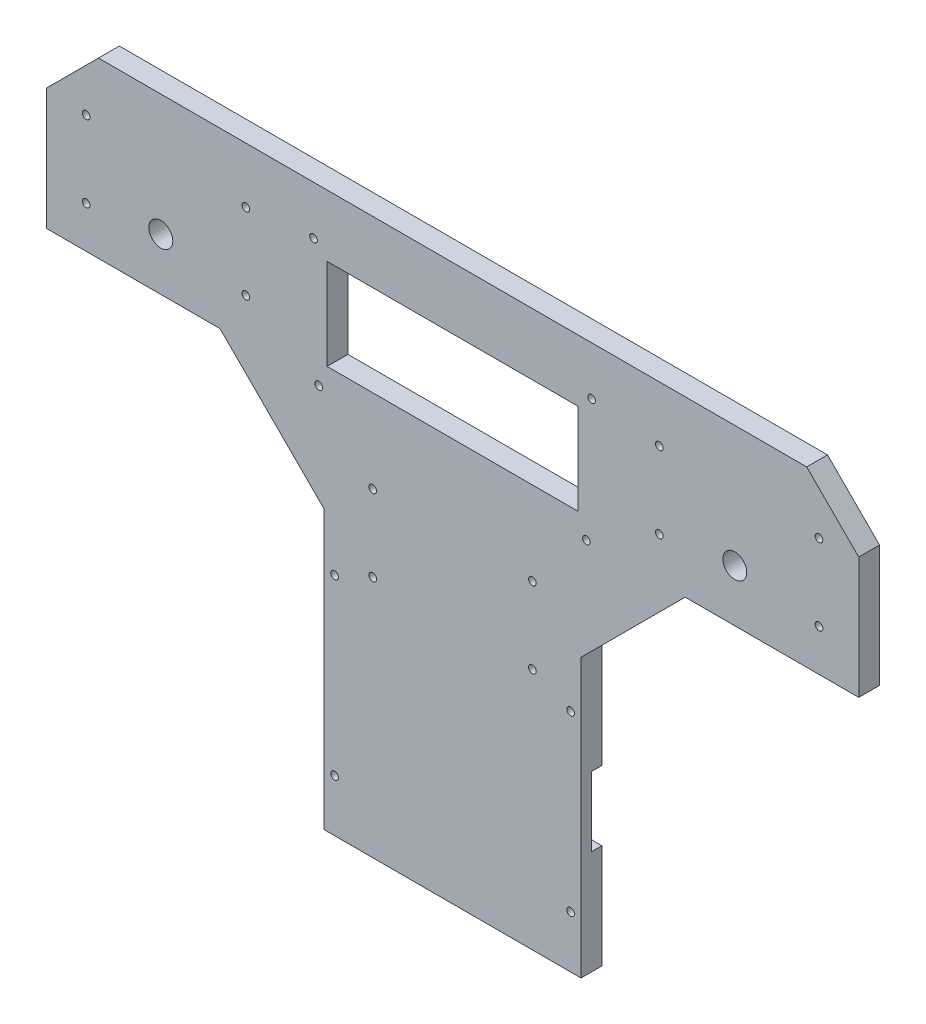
SolidWorks part; units mm, degrees
ref_plane "Plan de face" through (0, 0, 0) normal (0, 0, 1) x (1, 0, 0)
ref_plane "Plan de dessus" through (0, 0, 0) normal (0, 1, 0) x (1, 0, 0)
ref_plane "Plan de droite" through (0, 0, 0) normal (1, 0, 0) x (0, 0, -1)
sketch "Esquisse1" plane through (0, 0, 0) normal (0, 0, 1) x (1, 0, 0)
  line L0 (-9.3219, 0) -> (196.2538, 0) construction
  line L1 (0, -40.9334) -> (0, 154.9873) construction
  line L2 (74, -77.9334) -> (74, 117.9873) construction
  line L3 (186.9039, 110) -> (-9.6118, 110) construction
  line L4 (186.9039, 160) -> (-9.6118, 160) construction
  line L5 (154, -77.9334) -> (154, 172.3472) construction
  line L6 (104, 110) -> (74, 80) construction
  line L7 (37, 136.9233) -> (37, -58.1628) construction
  line L8 (-5.55, 150) -> (79.55, 150) construction
  line L9 (-5.55, 150) -> (-5.55, 106) construction
  line L10 (-5.55, 106) -> (79.55, 106) construction
  line L11 (79.55, 150) -> (79.55, 106) construction
  line L12 (-5.55, 150) -> (79.55, 106) construction
  line L13 (-5.55, 106) -> (79.55, 150) construction
  line L14 (46.2714, 81) -> (7.4137, 81) construction
  line L15 (0.85, 142.2) -> (73.15, 142.2)
  line L16 (0.85, 142.2) -> (0.85, 116)
  line L17 (0.85, 116) -> (73.15, 116)
  line L18 (73.15, 142.2) -> (73.15, 116)
  line L19 (0.85, 142.2) -> (73.15, 116) construction
  line L20 (154, 110) -> (104, 110)
  line L21 (104, 110) -> (74, 80)
  line L22 (74, 80) -> (74, 0)
  line L23 (154, 110) -> (154, 145)
  line L24 (139, 160) -> (173.5386, 125.4614) construction
  line L25 (119.55, 133) -> (119.55, 110) construction
  line L26 (92.55, 148) -> (146.55, 148) construction
  line L27 (92.55, 148) -> (92.55, 118) construction
  line L28 (92.55, 118) -> (146.55, 118) construction
  line L29 (146.55, 148) -> (146.55, 118) construction
  line L30 (92.55, 148) -> (146.55, 118) construction
  line L31 (92.55, 118) -> (146.55, 148) construction
  line L32 (96.55, 127.0105) -> (96.55, 111.5924) construction
  line L33 (89.5153, 122) -> (100.1734, 122) construction
  line L34 (119.55, 133) -> (137.8647, 133) construction
  line L35 (118.28, 129.9449) -> (118.28, 122.4052) construction
  line L36 (113.5403, 125) -> (126.5539, 125) construction
  line L37 (154, 145) -> (139, 160)
  line L38 (0, 80) -> (0, 0)
  line L39 (-30, 110) -> (0, 80)
  line L40 (-80, 110) -> (-30, 110)
  line L41 (-80, 110) -> (-80, 145)
  line L42 (-80, 145) -> (-65, 160)
  line L43 (-65, 160) -> (139, 160)
  line L44 (0, 0) -> (74, 0)
  line L45 (107.6717, 40) -> (61.783, 40) construction
  line L46 (92.7384, 30) -> (61.783, 30) construction
  line L47 (71, 0) -> (71, 30) construction
  line L48 (92.3545, 15) -> (71, 15) construction
  line L49 (37, 128) -> (37, 146) construction
  line L50 (0.85, 116) -> (73.15, 142.2) construction
  line L51 (64, 96) -> (10, 96) construction
  line L52 (64, 96) -> (64, 66) construction
  line L53 (-18.55, 118) -> (-72.55, 148) construction
  line L54 (-18.55, 148) -> (-72.55, 118) construction
  line L55 (-72.55, 148) -> (-72.55, 118) construction
  line L56 (-18.55, 118) -> (-72.55, 118) construction
  line L57 (-18.55, 148) -> (-18.55, 118) construction
  line L58 (-18.55, 148) -> (-72.55, 148) construction
  line L59 (64, 66) -> (10, 66) construction
  line L60 (10, 96) -> (10, 66) construction
  line L61 (64, 96) -> (10, 66) construction
  line L62 (64, 66) -> (10, 96) construction
  line L63 (7.4137, 70) -> (19.2202, 70) construction
  line L64 (14, 62.0044) -> (14, 73.8758) construction
  circle A0 centre (-3.05, 146) radius 1.1
  circle A1 centre (-1.55, 110) radius 1.1
  circle A2 centre (75.55, 110) radius 1.1
  circle A3 centre (77.05, 146) radius 1.1
  circle A4 centre (14, 70) radius 1.1
  circle A5 centre (14, 92) radius 1.1
  circle A6 centre (60, 70) radius 1.1
  circle A7 centre (60, 92) radius 1.1
  circle A8 centre (96.55, 122) radius 1.1
  circle A9 centre (142.55, 122) radius 1.1
  circle A10 centre (142.55, 144) radius 1.1
  circle A11 centre (96.55, 144) radius 1.1
  circle A12 centre (118.28, 125) radius 3.45
  circle A13 centre (-47.05, 125) radius 3.45
  circle A14 centre (-22.55, 144) radius 1.1
  circle A15 centre (-68.55, 144) radius 1.1
  circle A16 centre (-68.55, 122) radius 1.1
  circle A17 centre (-22.55, 122) radius 1.1
  circle A18 centre (71, 15) radius 1.1
  circle A19 centre (71, 65) radius 1.1
  circle A20 centre (3, 15) radius 1.1
  circle A21 centre (3, 65) radius 1.1
  point P17 (37, 129.1)
  point P26 (37, 81)
  point P47 (119.55, 133)
  dimension "D13" = 4
  dimension "D20" = 13
  dimension "D23" = 8
  dimension "D27" = 21.5
  dimension "D28" = 4
  dimension "D1" = 74
  dimension "D2" = 110
  dimension "D3" = 45
  dimension "D4" = 50
  dimension "D5" = 80
  dimension "D6" = 37
  dimension "D7" = 4
  dimension "D8" = 2.5
  dimension "D9" = 4
  dimension "D10" = 4
  dimension "D11" = 10
  dimension "D12" = 10
  dimension "D14" = 10
  dimension "D15" = 45
  dimension "D16" = 15
  dimension "D17" = 30
  dimension "D18" = 4
  dimension "D19" = 4
  dimension "D21" = 1.27
  dimension "D22" = 7
  dimension "D24" = 40
  dimension "D25" = 10
  dimension "D26" = 3
extrude "Boss.-Extru.1" add sketch "Esquisse1" along normal blind 6
sketch "Esquisse2" plane through (0, 0, 0) normal (0, 0, -1) x (-1, 0, 0)
  line L0 (-16.9168, 0) -> (41.4382, 0) construction
  line L1 (-16.9168, 40) -> (41.4382, 40) construction
  line L2 (0, -8.2315) -> (0, 100.142) construction
  line L3 (0, 80) -> (0, 0) construction
  line L4 (-6, -6.0133) -> (-6, 74.7012) construction
  line L5 (28.0494, 30) -> (-14.138, 30) construction
  line L6 (-6, 30) -> (6.0949, 42.0949) construction
  line L7 (-3.7373, 30) -> (0, 30)
  line L8 (-3.7373, 50) -> (0, 50)
  line L9 (-6, 47.7373) -> (-6, 32.2627)
  line L10 (0, 50) -> (0, 30)
  line L11 (-37, 0) -> (-37, -10.3222) construction
  line L12 (0, 0) -> (-74, 0) construction
  line L13 (-74, 50) -> (-74, 30)
  line L14 (-68, 47.7373) -> (-68, 32.2627)
  line L15 (-70.2627, 50) -> (-74, 50)
  line L16 (-70.2627, 30) -> (-74, 30)
  arc A0 (-6, 32.2627) -> (-3.7373, 30) centre (-4.8686, 31.1314) ccw
  arc A1 (-6, 47.7373) -> (-3.7373, 50) centre (-4.8686, 48.8686) cw
  arc A2 (-68, 47.7373) -> (-70.2627, 50) centre (-69.1314, 48.8686) ccw
  arc A3 (-68, 32.2627) -> (-70.2627, 30) centre (-69.1314, 31.1314) cw
  dimension "D1" = 45
  dimension "D2" = 40
  dimension "D3" = 10
  dimension "D4" = 6
extrude "Enlèv. mat.-Extru.1" cut sketch "Esquisse2" against normal blind 3
